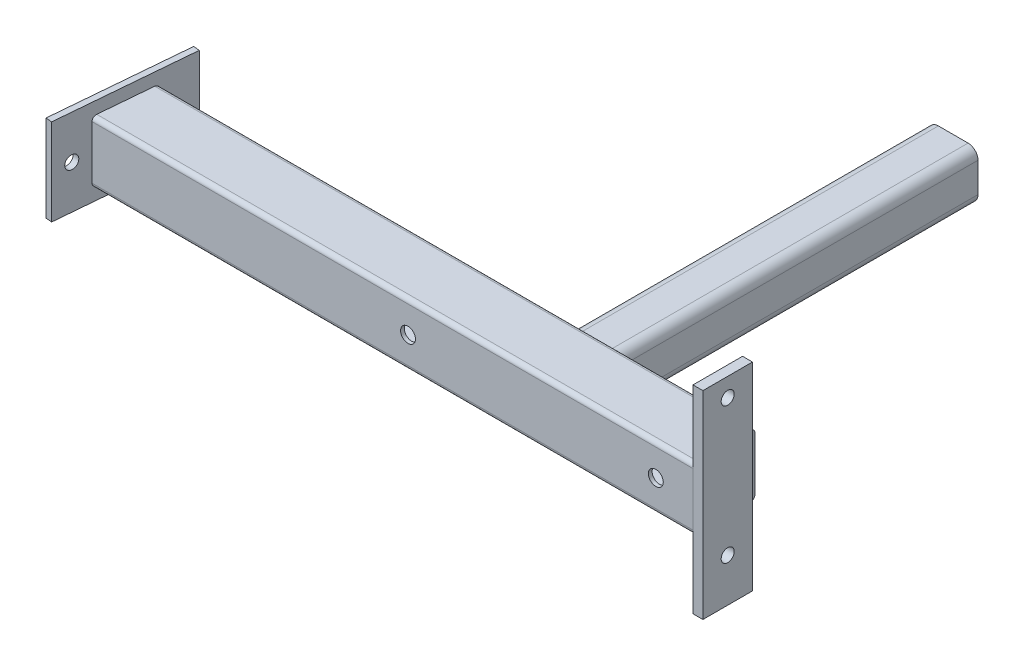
SolidWorks part; units mm, degrees
ref_plane "Plan de face" through (0, 0, 0) normal (0, 0, 1) x (1, 0, 0)
ref_plane "Plan de dessus" through (0, 0, 0) normal (0, 1, 0) x (1, 0, 0)
ref_plane "Plan de droite" through (0, 0, 0) normal (1, 0, 0) x (0, 0, -1)
sketch3d "Esquisse3D3"
  line L0 (-355, 0, 0) -> (130, 0, 0)
  line L1 (0, 0, -25) -> (0, 0, -315)
  dimension "D1" = 485
  dimension "D2" = 25
  dimension "D4" = 130
  dimension "D3" = 130
  dimension "D5" = 290
other "Elément mécano-soudé2"
ref_plane "Plan2" through (-355, 0, 0) normal (1, 0, 0) x (0, 0, -1)
sketch "Sketch12" plane through (-355, 0, 0) normal (1, 0, 0) x (0, 0, -1)
  line L0 (-21.5, -22) -> (21.5, -22)
  line L1 (-22, -21.5) -> (-22, 21.5)
  line L2 (21.5, 22) -> (-21.5, 22)
  line L3 (22, 21.5) -> (22, -21.5)
  line L4 (-21.5, -25) -> (21.5, -25)
  line L5 (-25, -21.5) -> (-25, 21.5)
  line L6 (21.5, 25) -> (-21.5, 25)
  line L7 (25, 21.5) -> (25, -21.5)
  arc A0 (25, 21.5) -> (21.5, 25) centre (21.5, 21.5) ccw
  arc A1 (21.5, -25) -> (25, -21.5) centre (21.5, -21.5) ccw
  arc A2 (-25, -21.5) -> (-21.5, -25) centre (-21.5, -21.5) ccw
  arc A3 (-21.5, 25) -> (-25, 21.5) centre (-21.5, 21.5) ccw
  arc A4 (-21.5, 22) -> (-22, 21.5) centre (-21.5, 21.5) ccw
  arc A5 (22, 21.5) -> (21.5, 22) centre (21.5, 21.5) ccw
  arc A6 (21.5, -22) -> (22, -21.5) centre (21.5, -21.5) ccw
  arc A7 (-22, -21.5) -> (-21.5, -22) centre (-21.5, -21.5) ccw
  point P0 (-25, 0)
  point P1 (25, 0)
  point P2 (0, 25)
  point P3 (0, -25)
  point P4 (0, 0)
  point P5 (-25, -25)
  point P6 (25, -25)
  point P7 (25, 25)
  point P8 (-25, 25)
  point P33 (0, 0)
  dimension "D1" = 3.5
  dimension "Thickness" = 3
  dimension "V_leg" = 50
ref_plane "Plan3" through (-350.1328, 0, -30.6326) normal (-0.9962, 0, -0.0872) x (-0.0872, 0, 0.9962)
sketch "Esquisse8" plane through (0, 0, -25) normal (0, 0, -1) x (-1, 0, 0)
  line L0 (-130, -21.5) -> (-130, 21.5) construction
  circle A0 centre (-100, 0) radius 6
  circle A1 centre (100, 0) radius 6
  dimension "D1" = 12
  dimension "D2" = 30
  dimension "D3" = 230
extrude "Enlèv. mat.-Extru.2" cut sketch "Esquisse8" against normal through all
sketch "Esquisse4" plane through (-350.1328, 0, -30.6326) normal (-0.9962, 0, -0.0872) x (-0.0872, 0, 0.9962)
  line L1 (-52.5136, 56.1819) -> (100.6499, 56.1819)
  line L2 (-52.5136, 56.1819) -> (-52.5136, -96.9816)
  line L3 (-52.5136, -96.9816) -> (100.6499, -96.9816)
  line L4 (100.6499, 56.1819) -> (100.6499, -96.9816)
extrude "Enlèv. mat.-Extru.1" cut sketch "Esquisse4" along normal through all
other "Elément mécano-soudé3"
ref_plane "Plan6" through (0, 0, 0) normal (0, 0, -1) x (1, 0, 0)
sketch "Sketch1" plane through (0, 0, -25) normal (0, 0, -1) x (1, 0, 0)
  line L0 (-12, -16) -> (12, -16)
  line L1 (-16, -12) -> (-16, 12)
  line L2 (12, 16) -> (-12, 16)
  line L3 (16, 12) -> (16, -12)
  line L4 (-12, -20) -> (12, -20)
  line L5 (-20, -12) -> (-20, 12)
  line L6 (12, 20) -> (-12, 20)
  line L7 (20, 12) -> (20, -12)
  arc A0 (20, 12) -> (12, 20) centre (12, 12) ccw
  arc A1 (12, -20) -> (20, -12) centre (12, -12) ccw
  arc A2 (-20, -12) -> (-12, -20) centre (-12, -12) ccw
  arc A3 (-12, 20) -> (-20, 12) centre (-12, 12) ccw
  arc A4 (-12, 16) -> (-16, 12) centre (-12, 12) ccw
  arc A5 (16, 12) -> (12, 16) centre (12, 12) ccw
  arc A6 (12, -16) -> (16, -12) centre (12, -12) ccw
  arc A7 (-16, -12) -> (-12, -16) centre (-12, -12) ccw
  point P0 (-20, 0)
  point P1 (20, 0)
  point P2 (0, 20)
  point P3 (0, -20)
  point P4 (0, 0)
  point P5 (-20, -20)
  point P6 (20, -20)
  point P7 (20, 20)
  point P8 (-20, 20)
  point P33 (0, 0)
  dimension "D1" = 8
  dimension "Thickness" = 4
  dimension "V_leg" = 40
sketch "Esquisse7" plane through (130, 0, 0) normal (1, 0, 0) x (0, 0, -1)
  line L0 (-25, 21.5) -> (-25, -21.5) construction
  line L1 (-25, 80) -> (15, 80)
  line L2 (-25, 80) -> (-25, -80)
  line L3 (-25, -80) -> (15, -80)
  line L4 (15, 80) -> (15, -80)
  circle A0 centre (-5, 65) radius 5.25
  circle A1 centre (-5, -45) radius 5.25
  dimension "D5" = 10.5
  dimension "D1" = 40
  dimension "D2" = 160
  dimension "D3" = 80
  dimension "D4" = 20
  dimension "D6" = 65
  dimension "D7" = 45
extrude "Boss.-Extru.1" add sketch "Esquisse7" along normal blind 8 separate body
sketch "Esquisse9" plane through (-350.1328, 0, -30.6326) normal (-0.9962, 0, -0.0872) x (-0.0872, 0, 0.9962)
  line L1 (85.9403, 35) -> (-24.0597, 35)
  line L2 (85.9403, 35) -> (85.9403, -35)
  line L3 (85.9403, -35) -> (-24.0597, -35)
  line L4 (-24.0597, 35) -> (-24.0597, -35)
  circle A0 centre (-9.0597, 0) radius 5.25
  circle A1 centre (70.9403, 0) radius 5.25
  dimension "D5" = 10.5
  dimension "D1" = 70
  dimension "D2" = 110
  dimension "D3" = 55
  dimension "D4" = 35
  dimension "D6" = 80
  dimension "D7" = 40
extrude "Boss.-Extru.2" add sketch "Esquisse9" along normal blind 5 separate body
